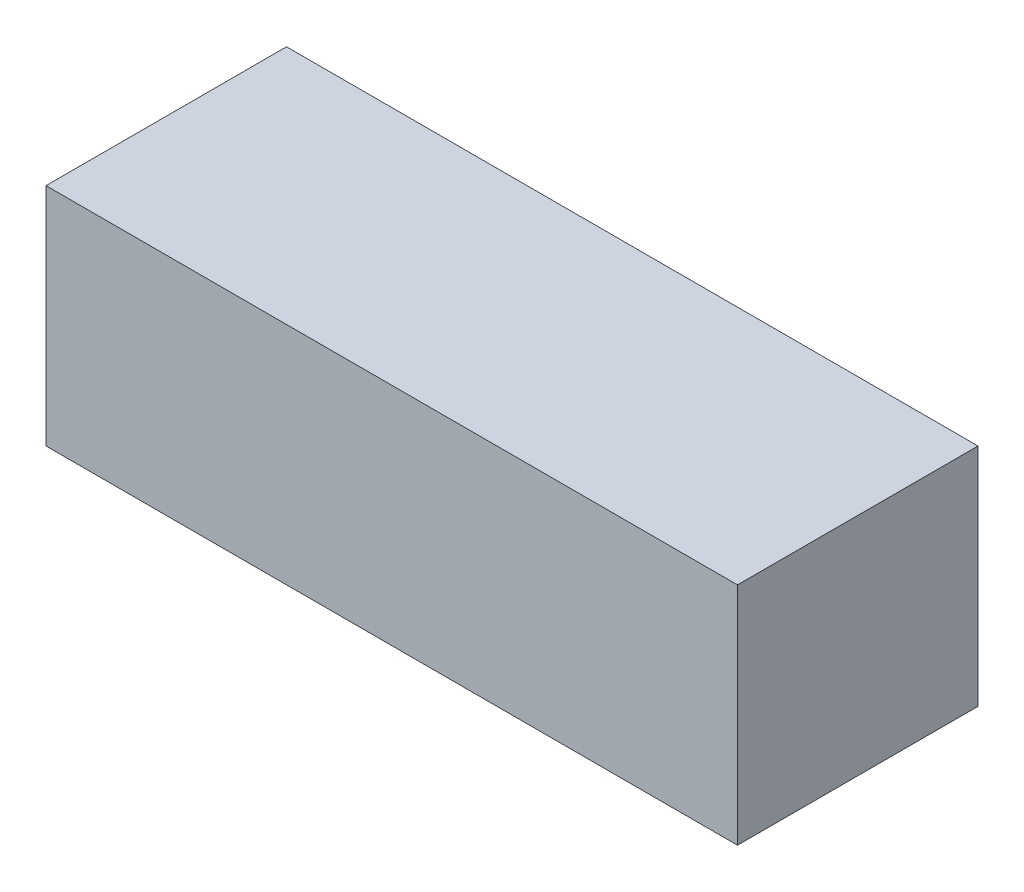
SolidWorks part; units mm, degrees
ref_plane "Front Plane" through (0, 0, 0) normal (0, 0, 1) x (1, 0, 0)
ref_plane "Top Plane" through (0, 0, 0) normal (0, 1, 0) x (1, 0, 0)
ref_plane "Right Plane" through (0, 0, 0) normal (1, 0, 0) x (0, 0, -1)
sketch "Sketch1" plane through (0, 0, 0) normal (0, 1, 0) x (1, 0, 0)
  line L1 (-115, 57.5) -> (115, 57.5)
  line L2 (-115, 57.5) -> (-115, -57.5)
  line L3 (-115, -57.5) -> (115, -57.5)
  line L4 (115, 57.5) -> (115, -57.5)
  line L5 (-115, 57.5) -> (115, -57.5) construction
  line L6 (-115, -57.5) -> (115, 57.5) construction
  point P0 (0, 0)
  dimension "D1" = 230
  dimension "D2" = 115
extrude "Boss-Extrude1" add sketch "Sketch1" along normal mid plane 75
sketch "Sketch2" plane through (0, 0, -57.5) normal (0, 0, -1) x (-1, 0, 0)
  line L0 (115, 37.5) -> (115, -37.5) construction
  line L1 (-115, 37.5) -> (115, 37.5) construction
  line L2 (-115, -37.5) -> (115, -37.5) construction
  line L3 (-115, 37.5) -> (-115, -37.5) construction
  line L4 (115, 37.5) -> (115, -37.5)
  line L5 (-115, 37.5) -> (115, 37.5)
  line L6 (-115, -37.5) -> (115, -37.5)
  line L7 (-115, 37.5) -> (-115, -37.5)
extrude "Cut-Extrude1" cut sketch "Sketch2" against normal blind 35
